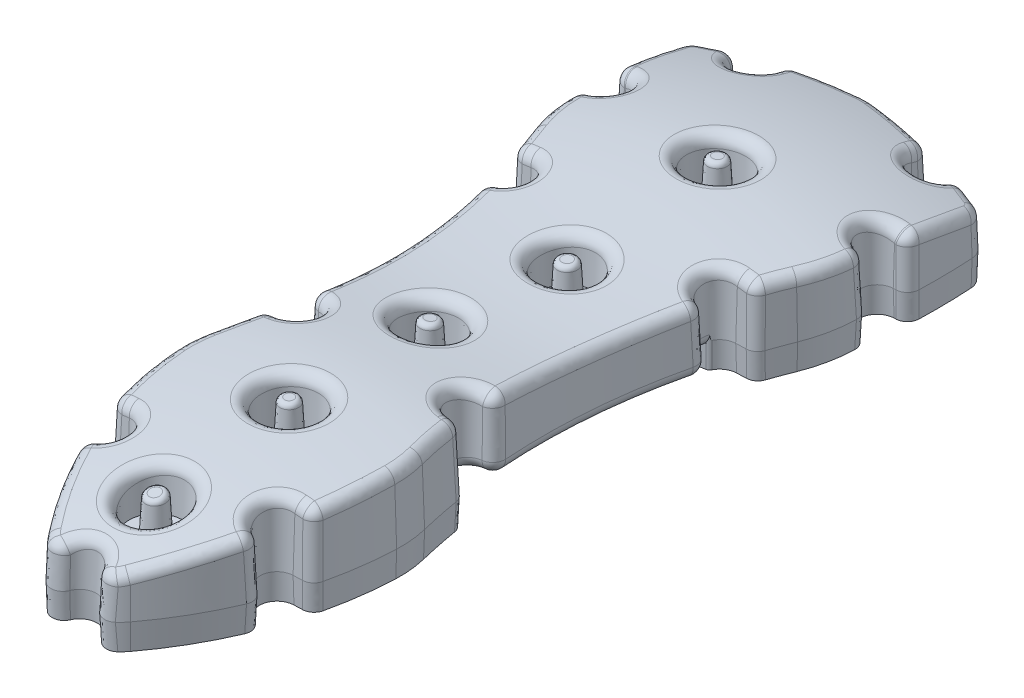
SolidWorks part; units mm, degrees
ref_plane "Front Plane" through (0, 0, 0) normal (0, 0, 1) x (1, 0, 0)
ref_plane "Top Plane" through (0, 0, 0) normal (0, 1, 0) x (1, 0, 0)
ref_plane "Right Plane" through (0, 0, 0) normal (1, 0, 0) x (0, 0, -1)
body saved out of another part "Stock-Motorcycle_Gear_Case_&-1"
